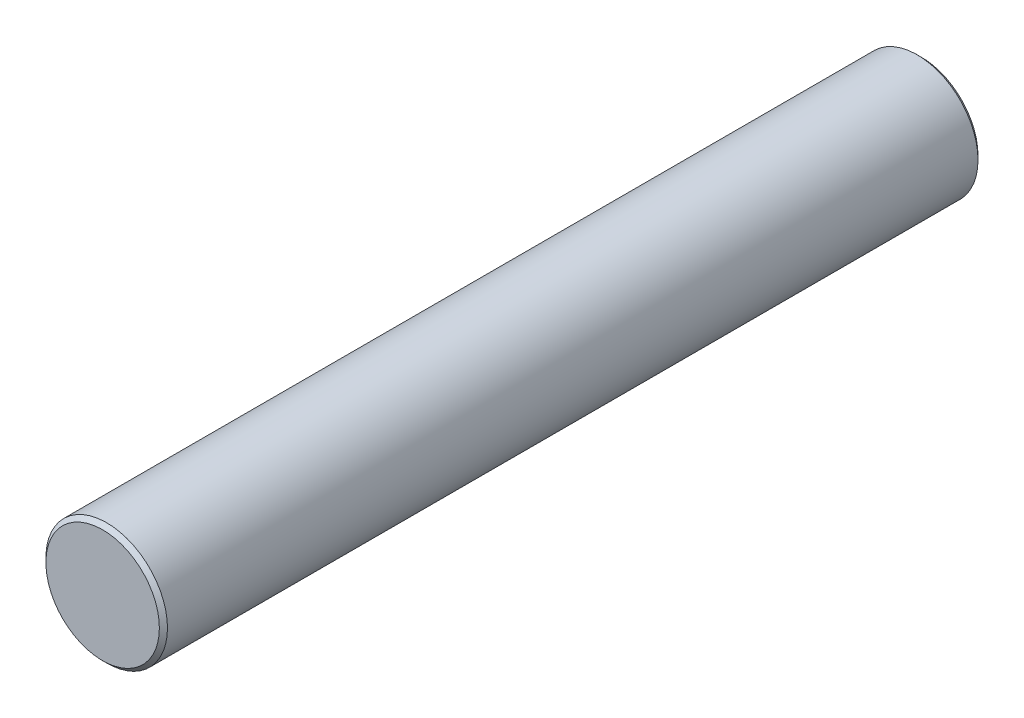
SolidWorks part; units mm, degrees
ref_plane "Face" through (0, 0, 0) normal (0, 0, 1) x (1, 0, 0)
ref_plane "Dessus" through (0, 0, 0) normal (0, 1, 0) x (1, 0, 0)
ref_plane "Droite" through (0, 0, 0) normal (1, 0, 0) x (0, 0, -1)
sketch "Esquisse1" plane through (0, 0, 0) normal (0, 0, 1) x (1, 0, 0)
  circle A0 centre (0, 0) radius 15
  dimension "D1" = 30
extrude "Extrusion1" add sketch "Esquisse1" along normal blind 202
chamfer "Chanfrein1" distance 1 angle 45
